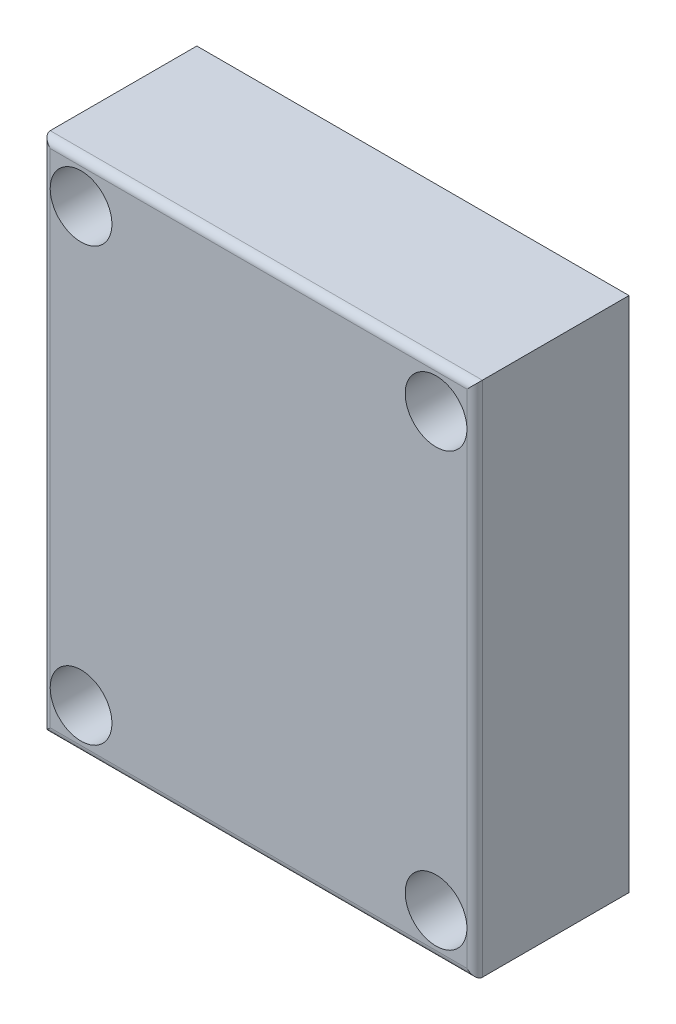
SolidWorks part; units mm, degrees
ref_plane "Plane1" through (0, 0, 0) normal (0, 0, 1) x (1, 0, 0)
ref_plane "Plane2" through (0, 0, 0) normal (0, 1, 0) x (1, 0, 0)
ref_plane "Plane3" through (0, 0, 0) normal (1, 0, 0) x (0, 0, -1)
sketch "Esquisse1" plane through (0, 0, 0) normal (0, 0, 1) x (1, 0, 0)
  line L0 (-16.1017, 0) -> (35.2798, 0) construction
  line L1 (0, 23.8424) -> (0, -24.6444) construction
  line L2 (0, 16.75) -> (14, 16.75)
  line L3 (14, 16.75) -> (14, 0)
  line L4 (0, 16.75) -> (0, 0)
  line L5 (0, 0) -> (14, 0)
  line L6 (-5.9701, 14) -> (18.3939, 14) construction
  line L7 (11.5, 20.9477) -> (11.5, 3.0968) construction
  circle A0 centre (11.5, 14) radius 1.25
  dimension "D5" = 2.5
  dimension "D1" = 14
  dimension "D2" = 16.75
  dimension "D3" = 11.5
  dimension "D4" = 14
extrude "Base-Extrusion" add sketch "Esquisse1" along normal blind 10
sketch "Esquisse2" plane through (0, 0, 10) normal (0, 0, 1) x (1, 0, 0)
  circle A0 centre (11.5, 14) radius 2
  dimension "D1" = 4
extrude "Enlèv. mat.-Extru.1" cut sketch "Esquisse2" against normal blind 3
mirror "Bossage-Symétrie3"
mirror "Bossage-Symétrie4"
fillet "Congé2" radius 0.5
